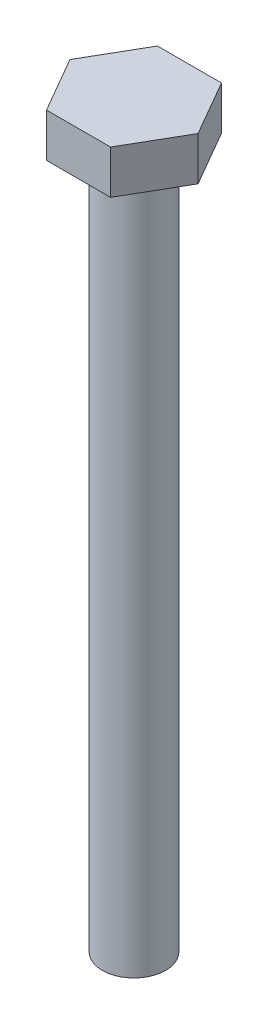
SolidWorks part; units mm, degrees
ref_plane "Front Plane" through (0, 0, 0) normal (0, 0, 1) x (1, 0, 0)
ref_plane "Top Plane" through (0, 0, 0) normal (0, 1, 0) x (1, 0, 0)
ref_plane "Right Plane" through (0, 0, 0) normal (1, 0, 0) x (0, 0, -1)
sketch "Sketch1" plane through (0, 0, 0) normal (0, 1, 0) x (1, 0, 0)
  circle A0 centre (0, 0) radius 3.175
  dimension "D1" = 6.35
extrude "Boss-Extrude1" add sketch "Sketch1" against normal blind 69.85
sketch "Sketch2" plane through (0, 0, 0) normal (0, 1, 0) x (1, 0, 0)
  line L1 (3.2079, -5.5563) -> (6.4158, 0)
  line L2 (6.4158, 0) -> (3.2079, 5.5563)
  line L3 (3.2079, 5.5563) -> (-3.2079, 5.5563)
  line L4 (-3.2079, 5.5563) -> (-6.4158, 0)
  line L5 (-6.4158, 0) -> (-3.2079, -5.5563)
  line L6 (-3.2079, -5.5563) -> (3.2079, -5.5563)
  circle A0 centre (0, 0) radius 5.5562 construction
  dimension "D1" = 11.1125
extrude "Boss-Extrude2" add sketch "Sketch2" along normal blind 4.3656
